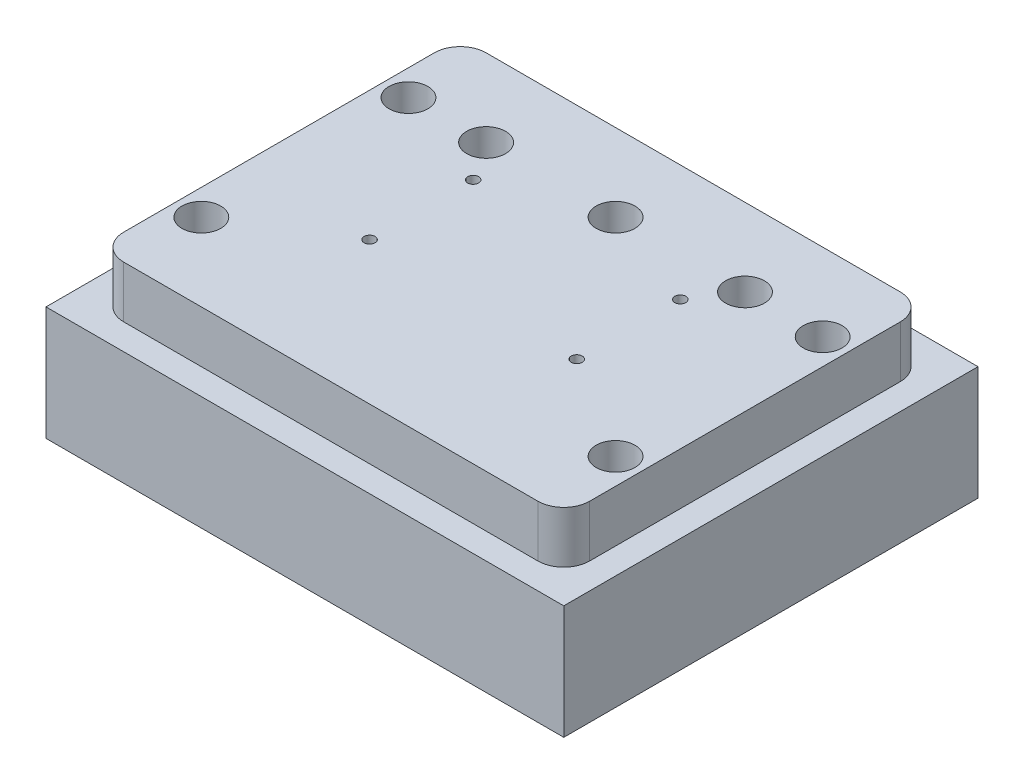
SolidWorks part; units mm, degrees
ref_plane "Front Plane" through (0, 0, 0) normal (0, 0, 1) x (1, 0, 0)
ref_plane "Top Plane" through (0, 0, 0) normal (0, 1, 0) x (1, 0, 0)
ref_plane "Right Plane" through (0, 0, 0) normal (1, 0, 0) x (0, 0, -1)
sketch "Sketch1" plane through (0, 0, 0) normal (0, 1, 0) x (1, 0, 0)
  line L1 (-46.7964, 20.7984) -> (80.2036, 20.7984)
  line L2 (-46.7964, 20.7984) -> (-46.7964, -80.8016)
  line L3 (-46.7964, -80.8016) -> (80.2036, -80.8016)
  line L4 (80.2036, 20.7984) -> (80.2036, -80.8016)
  dimension "D1" = 127
extrude "Boss-Extrude1" add sketch "Sketch1" along normal blind 27.94
sketch "Sketch2" plane through (0, 27.94, 0) normal (0, 1, 0) x (1, 0, 0)
  line L0 (-46.7964, 20.7984) -> (-46.7964, -80.8016) construction
  line L1 (-40.4464, 14.4484) -> (73.8536, 14.4484)
  line L2 (-40.4464, 14.4484) -> (-40.4464, -74.4516)
  line L3 (-40.4464, -74.4516) -> (73.8536, -74.4516)
  line L4 (73.8536, 14.4484) -> (73.8536, -74.4516)
  line L5 (80.2036, 20.7984) -> (-46.7964, 20.7984) construction
  dimension "D1" = 114.3
  dimension "D2" = 88.9
  dimension "D3" = 6.35
  dimension "D4" = 6.35
extrude "Boss-Extrude2" add sketch "Sketch2" along normal blind 12.7
hole_wizard "3/8 (0.375) Diameter Hole1" positions "Sketch3" profile "Sketch4" hole size "3/8" standard "ANSI Inch"
sketch "Sketch3" plane through (0, 40.64, 0) normal (0, 1, 0) x (1, 0, 0)
  line L0 (-40.4464, 14.4484) -> (-40.4464, -74.4516) construction
  line L1 (73.8536, -74.4516) -> (73.8536, 14.4484) construction
  line L2 (73.8536, 14.4484) -> (-40.4464, 14.4484) construction
  point P0 (-34.0964, -4.6016)
  point P8 (67.5036, -4.6016)
  point P17 (-34.0964, -55.4016)
  point P19 (67.5036, -55.4016)
  dimension "D1" = 6.35
  dimension "D6" = 6.35
  dimension "D7" = 19.05
  dimension "D8" = 50.8
  dimension "D9" = 50.8
sketch "Sketch4" plane through (-34.0964, 40.64, 4.6016) normal (1, 0, 0) x (0, 0, 1)
  line L0 (0, 0) -> (0, 40.64)
  line L1 (0, 40.64) -> (4.7625, 40.64)
  line L2 (4.7625, 40.64) -> (4.7625, 0)
  line L5 (4.7625, 0) -> (0, 0)
  line L11 (0, -6.35) -> (0, 107.95) construction
  dimension "Thru Hole Dia." = 9.525
  dimension "Thru Hole Depth" = 40.64
hole_wizard "3/8 (0.375) Diameter Hole2" positions "Sketch5" profile "Sketch7" hole size "3/8" standard "ANSI Inch"
sketch "Sketch5" plane through (0, 40.64, 0) normal (0, 1, 0) x (1, 0, 0)
  line L0 (-40.4464, 14.4484) -> (-40.4464, -74.4516) construction
  line L1 (73.8536, -74.4516) -> (73.8536, 14.4484) construction
  line L2 (73.8536, 14.4484) -> (-40.4464, 14.4484) construction
  point P0 (-15.0464, -4.6016)
  point P2 (16.7036, -4.6016)
  point P4 (48.4536, -4.6016)
  dimension "D1" = 25.4
  dimension "D2" = 31.75
  dimension "D3" = 31.75
  dimension "D4" = 25.4
  dimension "D5" = 19.05
sketch "Sketch7" plane through (-15.0464, 40.64, 4.6016) normal (1, 0, 0) x (0, 0, 1)
  line L0 (0, 0) -> (0, 35.8816)
  line L1 (0, 35.8816) -> (4.7625, 33.02)
  line L2 (4.7625, 33.02) -> (4.7625, 0)
  line L5 (4.7625, 0) -> (0, 0)
  line L10 (0, 35.8816) -> (-4.7625, 33.02) construction
  line L11 (0, -6.35) -> (0, 107.95) construction
  dimension "Hole Dia." = 9.525
  dimension "Hole Depth" = 33.02
  dimension "Drill Angle" = 118
hole_wizard "3/8-24 Tapped Hole1" positions "Sketch8" profile "Sketch9" tap size "3/8-24" standard "ANSI Inch"
sketch "Sketch8" plane through (0, 0, -20.7984) normal (0, 0, -1) x (-1, 0, 0)
  line L0 (-80.2036, 27.94) -> (-80.2036, 0) construction
  line L2 (-80.2036, 0) -> (46.7964, 0) construction
  point P0 (-16.7036, 12.7)
  dimension "D1" = 63.5
  dimension "D2" = 12.7
sketch "Sketch9" plane through (16.7036, 12.7, -20.7984) normal (1, 0, 0) x (0, 1, 0)
  line L0 (0, 0) -> (0, 27.9335)
  line L1 (0, 27.9335) -> (4.2164, 25.4)
  line L2 (4.2164, 25.4) -> (4.2164, 0)
  line L5 (4.2164, 0) -> (0, 0)
  line L10 (0, 27.9335) -> (-4.2164, 25.4) construction
  line L11 (0, -6.35) -> (0, 107.95) construction
  dimension "Tap Drill Dia." = 8.4328
  dimension "Tap Drill Depth" = 25.4
  dimension "Drill Angle" = 118
hole_wizard "3/8 (0.375) Diameter Hole3" positions "Sketch12" profile "Sketch11" hole size "3/8" standard "ANSI Inch"
sketch "Sketch12" plane through (0, 0, -20.7984) normal (0, 0, -1) x (-1, 0, 0)
  line L0 (-80.2036, 27.94) -> (-80.2036, 0) construction
  line L2 (-80.2036, 0) -> (46.7964, 0) construction
  point P0 (-48.4536, 12.7)
  point P2 (15.0464, 12.7)
  dimension "D1" = 31.75
  dimension "D2" = 63.5
  dimension "D3" = 12.7
  dimension "D4" = 12.7
sketch "Sketch11" plane through (48.4536, 12.7, -20.7984) normal (1, 0, 0) x (0, 1, 0)
  line L0 (0, 0) -> (0, 28.2616)
  line L1 (0, 28.2616) -> (4.7625, 25.4)
  line L2 (4.7625, 25.4) -> (4.7625, 0)
  line L5 (4.7625, 0) -> (0, 0)
  line L10 (0, 28.2616) -> (-4.7625, 25.4) construction
  line L11 (0, -6.35) -> (0, 107.95) construction
  dimension "Hole Dia." = 9.525
  dimension "Hole Depth" = 25.4
  dimension "Drill Angle" = 118
hole_wizard "#6-32 Tapped Hole1" positions "Sketch13" profile "Sketch14" tap size "#6-32" standard "ANSI Inch"
sketch "Sketch13" plane through (0, 40.64, 0) normal (0, 1, 0) x (1, 0, 0)
  line L0 (-40.4464, 14.4484) -> (-40.4464, -74.4516) construction
  line L1 (73.8536, 14.4484) -> (-40.4464, 14.4484) construction
  point P0 (-8.6964, -14.1266)
  point P2 (42.1036, -14.1266)
  point P4 (42.1036, -39.5266)
  point P6 (-8.6964, -39.5266)
  dimension "D1" = 25.4
  dimension "D2" = 25.4
  dimension "D3" = 50.8
  dimension "D4" = 50.8
  dimension "D5" = 31.75
  dimension "D6" = 28.575
sketch "Sketch14" plane through (-8.6964, 40.64, 14.1266) normal (1, 0, 0) x (0, 0, 1)
  line L0 (0, 0) -> (0, 8.4327)
  line L1 (0, 8.4327) -> (1.3525, 7.62)
  line L2 (1.3525, 7.62) -> (1.3525, 0)
  line L5 (1.3525, 0) -> (0, 0)
  line L10 (0, 8.4327) -> (-1.3526, 7.62) construction
  line L11 (0, -6.35) -> (0, 107.95) construction
  dimension "Tap Drill Dia." = 2.7051
  dimension "Tap Drill Depth" = 7.62
  dimension "Drill Angle" = 118
sketch "Sketch15" plane through (0, 0, -20.7984) normal (0, 0, -1) x (-1, 0, 0)
  line L1 (-63.0586, 18.415) -> (-33.8486, 18.415)
  line L2 (-63.0586, 18.415) -> (-63.0586, 6.985)
  line L3 (-63.0586, 6.985) -> (-33.8486, 6.985)
  line L4 (-33.8486, 18.415) -> (-33.8486, 6.985)
  line L6 (4.6324, 18.415) -> (25.4604, 18.415)
  line L7 (4.6324, 18.415) -> (4.6324, 6.985)
  line L8 (4.6324, 6.985) -> (25.4604, 6.985)
  line L9 (25.4604, 18.415) -> (25.4604, 6.985)
  circle A0 centre (-48.4536, 12.7) radius 4.7625 construction
  circle A1 centre (15.0464, 12.7) radius 4.7625 construction
  dimension "D1" = 29.21
  dimension "D2" = 11.43
  dimension "D3" = 14.605
  dimension "D4" = 5.715
  dimension "D5" = 20.828
  dimension "D6" = 11.43
  dimension "D7" = 5.715
  dimension "D8" = 10.414
extrude "Cut-Extrude1" cut sketch "Sketch15" against normal blind 12.7
hole_wizard "#4-40 Tapped Hole1" positions "Sketch16" profile "Sketch17" tap size "#4-40" standard "ANSI Inch"
sketch "Sketch16" plane through (0, 0, -20.7984) normal (0, 0, -1) x (-1, 0, 0)
  line L0 (-33.8486, 18.415) -> (-63.0586, 18.415) construction
  line L2 (25.4604, 18.415) -> (4.6324, 18.415) construction
  circle A0 centre (-48.4536, 12.7) radius 4.7625 construction
  circle A1 centre (15.0464, 12.7) radius 4.7625 construction
  point P0 (-65.116, 12.7)
  point P2 (-31.7912, 12.7)
  point P4 (2.5496, 12.7)
  point P6 (27.5432, 12.7)
  dimension "D1" = 33.3248
  dimension "D2" = 24.9936
  dimension "D3" = 16.6624
  dimension "D4" = 5.715
  dimension "D5" = 12.4968
  dimension "D6" = 5.715
sketch "Sketch17" plane through (65.116, 12.7, -20.7984) normal (1, 0, 0) x (0, 1, 0)
  line L0 (0, 0) -> (0, 10.2042)
  line L1 (0, 10.2042) -> (1.1303, 9.525)
  line L2 (1.1303, 9.525) -> (1.1303, 0)
  line L5 (1.1303, 0) -> (0, 0)
  line L10 (0, 10.2042) -> (-1.1303, 9.525) construction
  line L11 (0, -6.35) -> (0, 107.95) construction
  dimension "Tap Drill Dia." = 2.2606
  dimension "Tap Drill Depth" = 9.525
  dimension "Drill Angle" = 118
sketch "Sketch18" plane through (0, 40.64, 0) normal (0, 1, 0) x (1, 0, 0)
  line L0 (73.8536, 14.4484) -> (-40.4464, 14.4484) construction
  line L1 (-40.4464, 14.4484) -> (-40.4464, -74.4516) construction
  line L2 (73.8536, 14.4484) -> (-40.4464, 14.4484) construction
  line L3 (73.8536, -74.4516) -> (73.8536, 14.4484) construction
  line L4 (73.8536, -74.4516) -> (73.8536, 14.4484) construction
  line L5 (-40.4464, -74.4516) -> (73.8536, -74.4516) construction
  line L6 (-40.4464, 14.4484) -> (-40.4464, -74.4516) construction
  line L7 (-40.4464, 8.0984) -> (-40.4464, 14.4484)
  line L8 (-40.4464, 14.4484) -> (-34.0964, 14.4484)
  line L9 (-34.0964, 14.4484) -> (-34.0964, 8.0984)
  line L10 (-34.0964, 8.0984) -> (-40.4464, 8.0984)
  line L11 (67.5036, 14.4484) -> (73.8536, 14.4484)
  line L12 (73.8536, 14.4484) -> (73.8536, 8.0984)
  line L13 (73.8536, 8.0984) -> (73.8536, 14.4484)
  line L14 (73.8536, 14.4484) -> (67.5036, 14.4484)
  line L15 (67.5036, -74.4516) -> (73.8536, -74.4516)
  line L16 (73.8536, -74.4516) -> (73.8536, -68.1016)
  line L17 (73.8536, -68.1016) -> (67.5036, -74.4516)
  line L18 (-40.4464, -74.4516) -> (-40.4464, -68.1016)
  line L19 (-40.4464, -68.1016) -> (-34.0964, -74.4516)
  line L20 (-34.0964, -74.4516) -> (-40.4464, -74.4516)
  circle A0 centre (-34.0964, 8.0984) radius 6.35
  circle A1 centre (67.5036, 8.0984) radius 6.35
  circle A2 centre (67.5036, -68.1016) radius 6.35
  circle A3 centre (-34.0964, -68.1016) radius 6.35
  dimension "D1" = 6.35
  dimension "D2" = 6.35
  dimension "D3" = 6.35
  dimension "D4" = 6.35
  dimension "D5" = 6.35
  dimension "D6" = 6.35
  dimension "D7" = 6.35
  dimension "D8" = 6.35
extrude "Cut-Extrude2" cut sketch "Sketch18" against normal blind 12.7 contours A0 M16 M13 | A1 M15 M16 | A2 M14 M15 | A3 M13 M14
